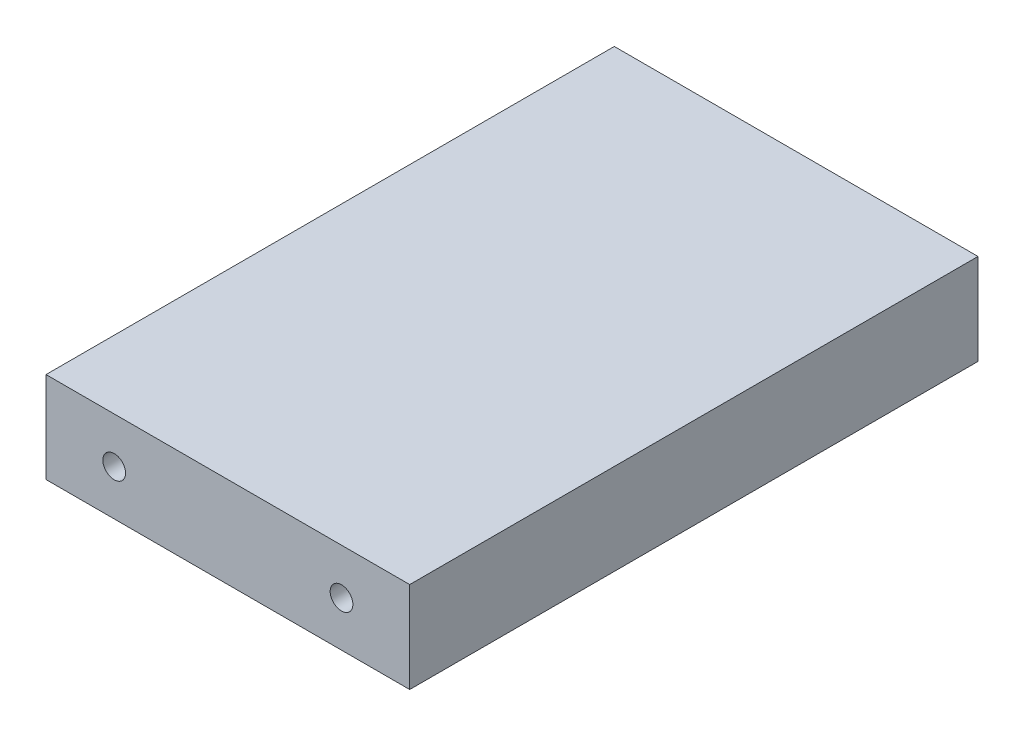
SolidWorks part; units mm, degrees
ref_plane "Plan de face" through (0, 0, 0) normal (0, 0, 1) x (1, 0, 0)
ref_plane "Plan de dessus" through (0, 0, 0) normal (0, 1, 0) x (1, 0, 0)
ref_plane "Plan de droite" through (0, 0, 0) normal (1, 0, 0) x (0, 0, -1)
sketch "Esquisse1" plane through (0, 0, 0) normal (0, 0, 1) x (1, 0, 0)
  line L1 (0, 0) -> (-80, 0)
  line L2 (0, 0) -> (0, 20)
  line L3 (0, 20) -> (-80, 20)
  line L4 (-80, 0) -> (-80, 20)
  dimension "D1" = 80
  dimension "D2" = 20
extrude "Boss.-Extru.1" add sketch "Esquisse1" along normal blind 125
hole_wizard "Trou taraudé M61" positions "Esquisse3" profile "Esquisse4" tap size "M6" standard "ISO"
sketch "Esquisse3" plane through (0, 0, 125) normal (0, 0, 1) x (1, 0, 0)
  line L0 (-80, 20) -> (-80, 0) construction
  point P0 (-65, 9.9586)
  point P2 (-15, 9.9586)
  dimension "D1" = 50
  dimension "D2" = 15
sketch "Esquisse4" plane through (-65, 9.9586, 125) normal (1, 0, 0) x (0, -1, 0)
  line L0 (0, 0) -> (0, 28.5022)
  line L1 (0, 28.5022) -> (2.5, 27)
  line L2 (2.5, 27) -> (2.5, 0)
  line L5 (2.5, 0) -> (0, 0)
  line L10 (0, 28.5022) -> (-2.5, 27) construction
  line L11 (0, -6.35) -> (0, 107.95) construction
  dimension "Diamètre du trou pour taraudage" = 5
  dimension "Profondeur du trou pour taraudage" = 27
  dimension "Angle de pointe" = 118
